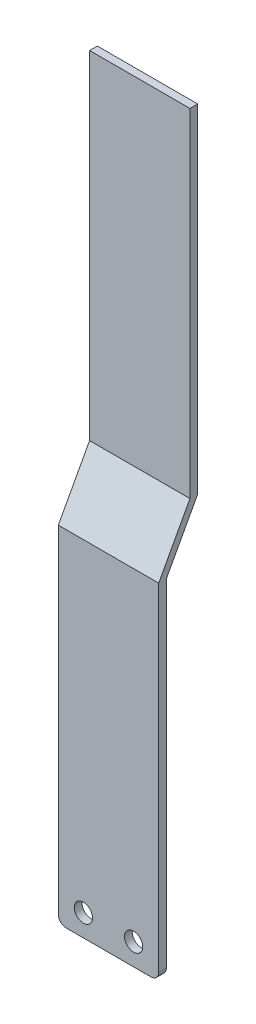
SolidWorks part; units mm, degrees
ref_plane "Front Plane" through (0, 0, 0) normal (0, 0, 1) x (1, 0, 0)
ref_plane "Top Plane" through (0, 0, 0) normal (0, 1, 0) x (1, 0, 0)
ref_plane "Right Plane" through (0, 0, 0) normal (1, 0, 0) x (0, 0, -1)
sketch "Sketch5" plane through (0, 0, 0) normal (0, 0, 1) x (1, 0, 0)
  line L5 (-16.129, 49.4356) -> (-16.129, 151.8049)
  line L6 (-16.129, 151.8049) -> (16.8766, 151.8049)
  line L7 (-13.589, 38.4002) -> (14.3366, 38.4002)
  line L8 (-16.129, 40.9402) -> (-16.129, 49.4356)
  line L9 (16.8766, 40.9402) -> (16.8766, 49.4356)
  line L10 (-17.7882, 151.8049) -> (26.6704, 151.8049) construction
  line L11 (16.8766, 151.8049) -> (16.8766, 49.4356)
  circle A6 centre (-7.8776, 45.5871) radius 2.9925
  circle A7 centre (8.6252, 45.5871) radius 2.9925
  arc A8 (-16.129, 40.9402) -> (-13.589, 38.4002) centre (-13.589, 40.9402) ccw
  arc A9 (14.3366, 38.4002) -> (16.8766, 40.9402) centre (14.3366, 40.9402) ccw
extrude "Boss-Extrude2" add sketch "Sketch5" along normal blind 2.54
sketch "Sketch7" plane through (16.8766, 0, 0) normal (1, 0, 0) x (0, 0, -1)
  line L1 (-2.54, 151.8049) -> (0, 151.8049)
  line L3 (10.2792, 281.8281) -> (7.7392, 281.8281)
  line L9 (-2.54, 151.8049) -> (7.7392, 170.7437)
  line L10 (0, 151.8049) -> (10.2792, 170.7437)
  line L12 (10.2792, 170.7437) -> (10.2792, 281.8281)
  line L13 (7.7392, 170.7437) -> (7.7392, 281.8281)
extrude "Boss-Extrude3" add sketch "Sketch7" against normal up to vertex (33.0057 mm away)
